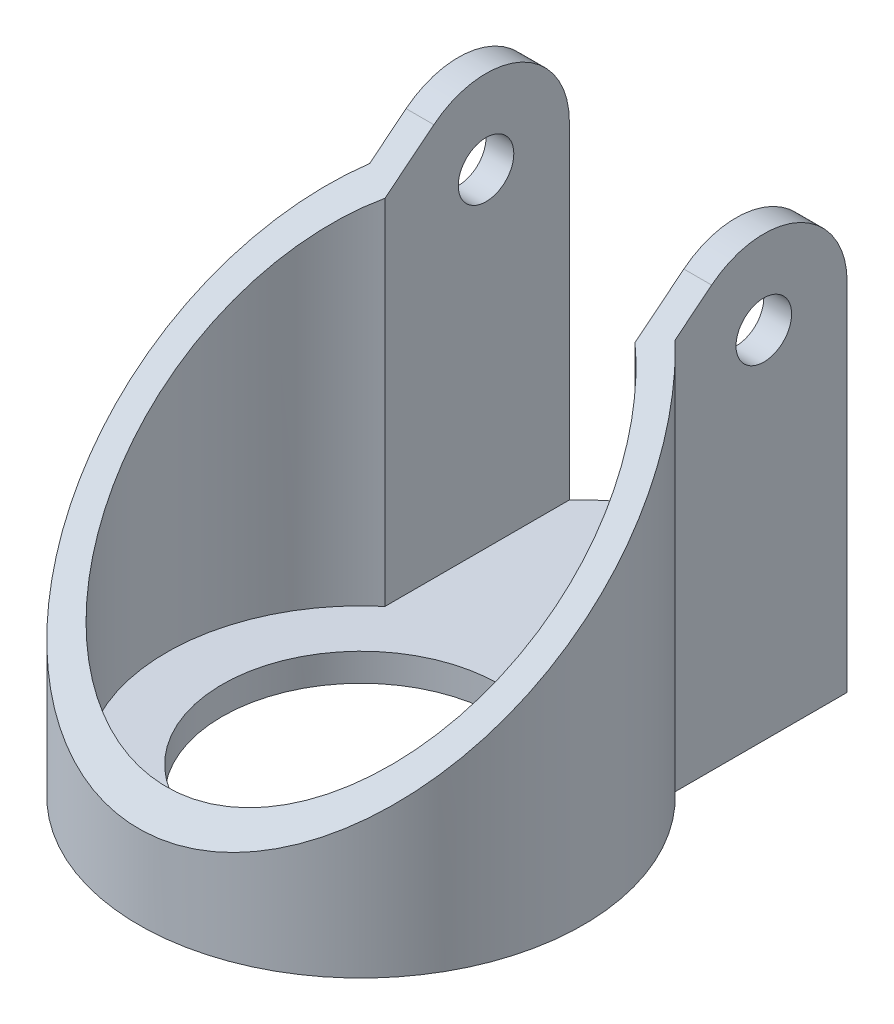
SolidWorks part; units mm, degrees
ref_plane "Plan de face" through (0, 0, 0) normal (0, 0, 1) x (1, 0, 0)
ref_plane "Plan de dessus" through (0, 0, 0) normal (0, 1, 0) x (1, 0, 0)
ref_plane "Plan de droite" through (0, 0, 0) normal (1, 0, 0) x (0, 0, -1)
sketch "Esquisse1" plane through (0, 0, 0) normal (0, 1, 0) x (1, 0, 0)
  line L0 (-27.5, 29.0474) -> (-27.5, 60)
  line L1 (-27.5, 60) -> (-22.5, 60)
  line L2 (22.5, 60) -> (27.5, 60)
  line L3 (27.5, 60) -> (27.5, 29.0474)
  arc A0 (-27.5, 29.0474) -> (27.5, 29.0474) centre (0, 0) ccw
  arc A1 (-22.5, 60) -> (22.5, 60) centre (0, 39.6875) cw
  circle A2 centre (0, 0) radius 25
  dimension "D1" = 80
  dimension "D6" = 60
  dimension "D7" = 10
  dimension "D8" = 50
  dimension "D2" = 27.5
  dimension "D3" = 55
  dimension "D4" = 5
  dimension "D5" = 5
extrude "Extrusion1" add sketch "Esquisse1" along normal blind 100
sketch "Esquisse2" plane through (0, 0, 0) normal (1, 0, 0) x (0, 0, -1)
  line L0 (-40, 15) -> (35.6098, 75.6972)
  line L1 (60, 64) -> (60, 5)
  line L2 (60, 5) -> (70, 5)
  line L3 (70, 5) -> (70, 0)
  line L4 (70, 0) -> (-40, 0)
  line L5 (-40, 0) -> (-40, 15)
  line L6 (-40, 100) -> (-40, 0) construction
  line L7 (70, 0) -> (70, 100) construction
  line L8 (60, 100) -> (60, 0) construction
  arc A0 (35.6098, 75.6972) -> (60, 64) centre (45, 64) cw
  circle A1 centre (45, 64) radius 5
  dimension "D1" = 10
  dimension "D2" = 15
  dimension "D3" = 5
  dimension "D4" = 15
  dimension "D5" = 64
extrude "Enlèv. mat.-Extru.2" cut sketch "Esquisse2" against normal mid plane 100 flip side to cut
ref_plane "Plan1" through (0, 5, 0) normal (0, -1, 0) x (1, 0, 0)
sketch "Esquisse3" plane through (0, 5, 0) normal (0, -1, 0) x (1, 0, 0)
  line L8 (-22.5, -65) -> (-22.5, -26.8095)
  line L10 (22.5, -65) -> (-22.5, -65)
  line L11 (22.5, -26.8095) -> (22.5, -65)
  arc A4 (22.5, -26.8095) -> (-22.5, -26.8095) centre (0, 0) ccw
  dimension "D1" = 35
  dimension "D2" = 45
  dimension "D3" = 65
  dimension "D7" = 22.5
extrude "Enlèv. mat.-Extru.3" cut sketch "Esquisse3" against normal blind 100
